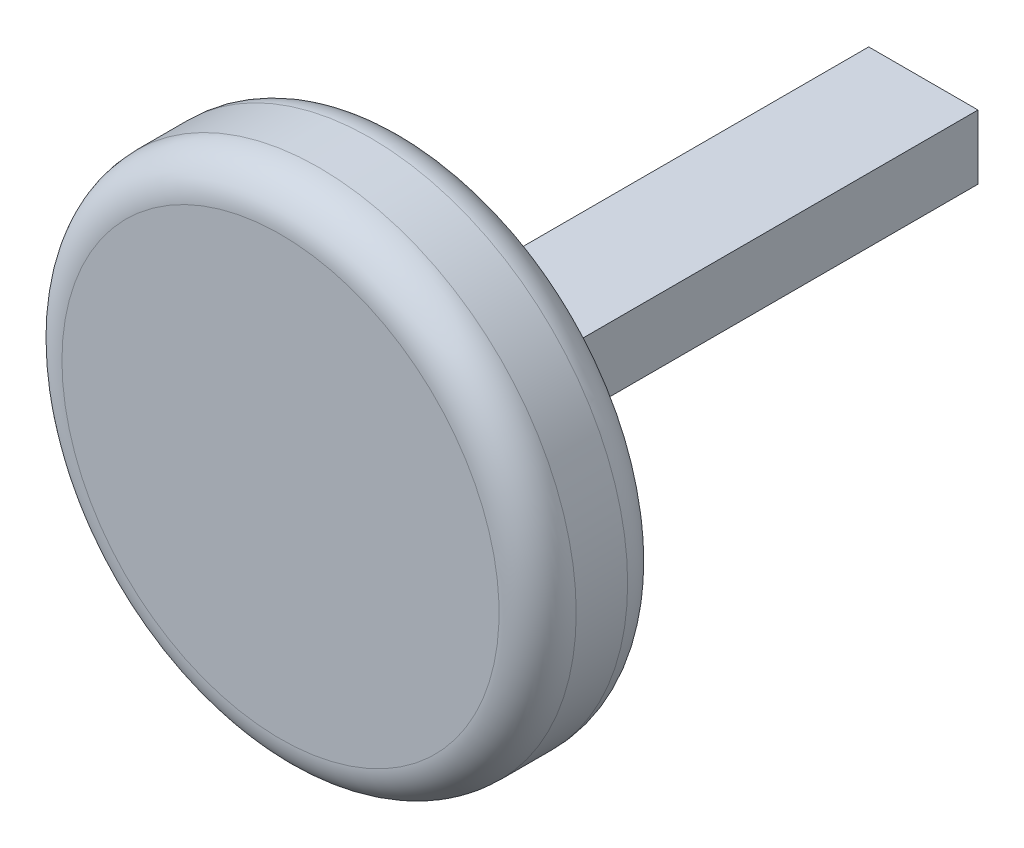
SolidWorks part; units mm, degrees
ref_plane "Plan de face" through (0, 0, 0) normal (0, 0, 1) x (1, 0, 0)
ref_plane "Plan de dessus" through (0, 0, 0) normal (0, 1, 0) x (1, 0, 0)
ref_plane "Plan de droite" through (0, 0, 0) normal (1, 0, 0) x (0, 0, -1)
sketch "Esquisse1" plane through (0, 0, 0) normal (0, 0, 1) x (1, 0, 0)
  line L0 (-8.5, -5) -> (8.5, 5) construction
  line L1 (-8.5, -5) -> (8.5, -5)
  line L2 (-8.5, -5) -> (-8.5, 5)
  line L3 (-8.5, 5) -> (8.5, 5)
  line L4 (8.5, -5) -> (8.5, 5)
  dimension "D1" = 17
  dimension "D2" = 10
extrude "Boss.-Extru.1" add sketch "Esquisse1" along normal blind 100
sketch "Esquisse2" plane through (0, 0, 0) normal (0, 1, 0) x (1, 0, 0)
  line L0 (8.5, -100) -> (-8.5, -100) construction
  line L1 (0, -80) -> (34, -80)
  line L2 (0, -80) -> (0, -100)
  line L3 (0, -100) -> (34, -100)
  line L4 (40, -94) -> (40, -86)
  arc A0 (40, -80) -> (40, -100) centre (40, -90) cw construction
  arc A1 (34, -80) -> (40, -86) centre (34, -86) cw
  arc A2 (40, -94) -> (34, -100) centre (34, -94) cw
  dimension "D1" = 10
  dimension "D3" = 6
  dimension "D2" = 40
revolve "Révolution1" add sketch "Esquisse2" angle 360 about L2
sketch "Esquisse3" plane through (0, 0, 100) normal (0, 0, 1) x (1, 0, 0)
  line L0 (-21.701, -35.5707) -> (-21.701, -37.6085) construction
  point P0 (-21.701, 0)
